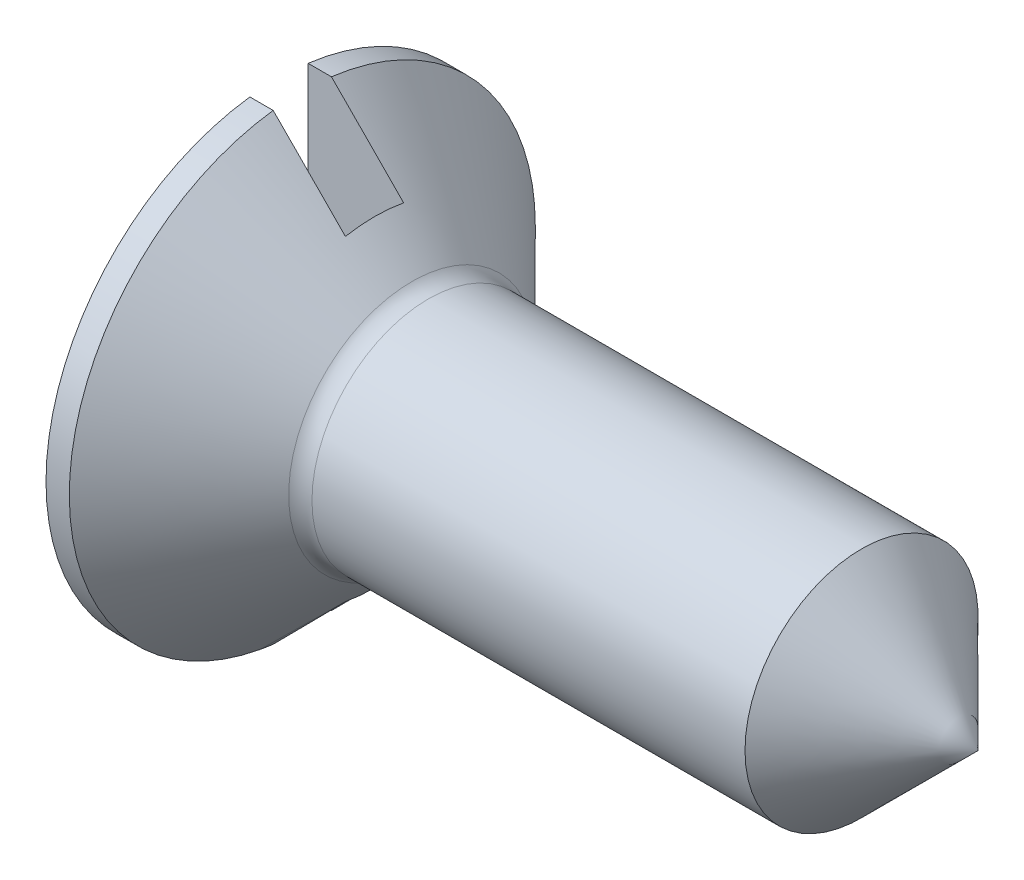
SolidWorks part; units mm, degrees
ref_plane "Front" through (0, 0, 0) normal (0, 0, 1) x (1, 0, 0)
ref_plane "Top" through (0, 0, 0) normal (0, 1, 0) x (1, 0, 0)
ref_plane "Right" through (0, 0, 0) normal (1, 0, 0) x (0, 0, -1)
other "Configuration Table"
sketch "Sketch2" plane through (1.6093, 0, 0.5907) normal (0, 1, 0) x (0, 0, -1)
  line L0 (0.5907, -4.3907) -> (0.5907, 1.3247) construction
  line L3 (1.5907, 0.4093) -> (2.7907, 1.6093)
  line L5 (0.5907, 0.4093) -> (1.5907, 0.4093)
  line L6 (2.7907, 1.6093) -> (0.5907, 1.6093)
  line L7 (0.5907, 1.6093) -> (0.5907, 0.4093)
revolve "BaseHead" add sketch "Sketch2" angle 360 about L0
sketch "Sketch1" plane through (1.2, -0.0348, 0.0561) normal (1, 0, 0) x (0, 0, -1)
  circle A0 centre (0.0561, 0.0348) radius 1
extrude "BaseBody" add sketch "Sketch1" along normal blind 4.8
sketch "Sketch3" plane through (0, -1.059, 0.7678) normal (-1, 0, 0) x (0, 0, 1)
  circle A0 centre (-0.7678, 1.059) radius 2
  circle A1 centre (-0.7678, 1.059) radius 2.2 construction
  circle A3 centre (-0.7678, 1.059) radius 2.2
  dimension "dk" = 4
extrude "Cut-Extrude1" cut sketch "Sketch3" against normal through all
sketch "Sketch4" plane through (1.4152, 0, -1.4152) normal (0, 1, 0) x (0, 0, -1)
  line L0 (-1.4152, 0.4723) -> (-1.4152, 2.4503) construction
  line L1 (-1.1652, 0.5952) -> (-1.6652, 0.5952)
  line L2 (-1.1652, 0.5952) -> (-1.1652, 1.4152)
  line L3 (-1.1652, 1.4152) -> (-1.6652, 1.4152)
  line L4 (-1.6652, 0.5952) -> (-1.6652, 1.4152)
  line L7 (0.5848, 1.4152) -> (-3.4152, 1.4152) construction
  dimension "n" = 0.5
  dimension "t" = 0.82
extrude "Slot" cut sketch "Sketch4" against normal through all and the other way through all
sketch "Sketch5" plane through (23.6694, -6.3306, 0) normal (0, 0, 1) x (0, 1, 0)
  line L0 (6.3306, -6.6611) -> (6.3306, -3.7572) construction
  line L2 (6.3306, 17.324) -> (36.3306, 17.324)
  line L3 (36.3306, 17.324) -> (36.3306, 47.6694)
  line L4 (36.3306, 47.6694) -> (6.3306, 17.6694)
  line L5 (6.3306, 17.6694) -> (6.3306, 17.324)
  line L7 (5.3306, 17.6694) -> (7.3306, 17.6694) construction
  dimension "D1" = 45
  dimension "D2" = 30
  dimension "D3" = 0.3455
revolve "Cut-Revolve1" cut sketch "Sketch5" angle 360 about L0
fillet "Fillet1" radius 0.2 1 edges at (1.2, 0, -1)
sketch "Sketch6" [suppressed] plane through (0, 0, 0) normal (0, 0, 1) x (1, 0, 0)
  line L0 (3.2, 1.2) -> (3.45, 1.2)
  line L1 (3.45, 1.2) -> (3.45, 1)
  line L2 (3.45, 1) -> (3.325, 0.7835)
  line L3 (3.2, 1) -> (3.325, 0.7835)
  line L4 (3.2, 1.2) -> (3.2, 1)
  line L5 (10.7743, 0) -> (0, 0) construction
  line L6 (3.2, 1) -> (3.45, 1) construction
  line L7 (3.325, 1) -> (3.325, 0.7835) construction
  line L8 (6.2, 1) -> (1.2828, 1) construction
  point P5 (3.325, 1.2)
revolve "Cut-Revolve10" [suppressed] cut sketch "Sketch6" angle 360 about L5
pattern_linear "LPattern10" [suppressed] count 8 spacing 0.5
equation "\"D1@Sketch2\" = \"d@Sketch1\" / 2"
equation "\"D3@Sketch6\" = \"D1@ThreadCosmetic1\" + \"d@Sketch1\" / 2"
equation "\"D2@Sketch6\" = (  \"d@Sketch1\" - \"D2@ThreadCosmetic1\" )  / 2"
equation "\"D3@LPattern10\" = \"D2@Sketch6\" * 2"
equation "\"D1@LPattern10\" = \"D3@Sketch6\" / \"D3@LPattern10\""
equation "\"l@BaseBody\" = \"l@Sketch2\" - \"k@Sketch2\""
